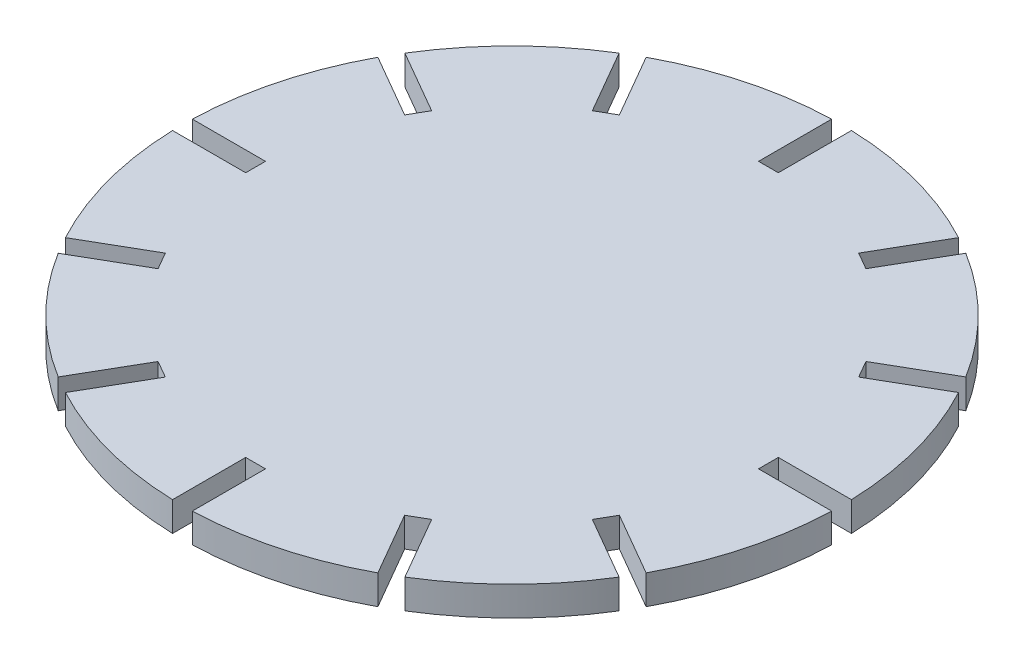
SolidWorks part; units mm, degrees
ref_plane "Front Plane" through (0, 0, 0) normal (0, 0, 1) x (1, 0, 0)
ref_plane "Top Plane" through (0, 0, 0) normal (0, 1, 0) x (1, 0, 0)
ref_plane "Right Plane" through (0, 0, 0) normal (1, 0, 0) x (0, 0, -1)
sketch "Sketch1" plane through (0, 0, 0) normal (0, 1, 0) x (1, 0, 0)
  line L0 (0, 34.9997) -> (0, -45) construction
  line L1 (30.9857, -16.3307) -> (39.6286, -21.3207)
  line L2 (55.4826, 0) -> (45, 0) construction
  line L3 (34.9997, -1.35) -> (44.9797, -1.35)
  line L4 (34.9997, -1.35) -> (34.9997, 1.35)
  line L5 (34.9997, 1.35) -> (44.9797, 1.35)
  line L7 (34.9997, -1.35) -> (44.9797, 1.35) construction
  line L8 (34.9997, 1.35) -> (44.9797, -1.35) construction
  line L9 (29.6357, -18.669) -> (38.2786, -23.659)
  line L10 (29.6357, -18.669) -> (30.9857, -16.3307)
  line L11 (18.669, -29.6357) -> (23.659, -38.2786)
  line L12 (16.3307, -30.9857) -> (21.3207, -39.6286)
  line L13 (16.3307, -30.9857) -> (18.669, -29.6357)
  line L14 (1.35, -34.9997) -> (1.35, -44.9797)
  line L15 (-1.35, -34.9997) -> (-1.35, -44.9797)
  line L16 (-1.35, -34.9997) -> (1.35, -34.9997)
  line L17 (-16.3307, -30.9857) -> (-21.3207, -39.6286)
  line L18 (-18.669, -29.6357) -> (-23.659, -38.2786)
  line L19 (-18.669, -29.6357) -> (-16.3307, -30.9857)
  line L20 (-29.6357, -18.669) -> (-38.2786, -23.659)
  line L21 (-30.9857, -16.3307) -> (-39.6286, -21.3207)
  line L22 (-30.9857, -16.3307) -> (-29.6357, -18.669)
  line L23 (-34.9997, -1.35) -> (-44.9797, -1.35)
  line L24 (-34.9997, 1.35) -> (-44.9797, 1.35)
  line L25 (-34.9997, 1.35) -> (-34.9997, -1.35)
  line L26 (-30.9857, 16.3307) -> (-39.6286, 21.3207)
  line L27 (-29.6357, 18.669) -> (-38.2786, 23.659)
  line L28 (-29.6357, 18.669) -> (-30.9857, 16.3307)
  line L29 (-18.669, 29.6357) -> (-23.659, 38.2786)
  line L30 (-16.3307, 30.9857) -> (-21.3207, 39.6286)
  line L31 (-16.3307, 30.9857) -> (-18.669, 29.6357)
  line L32 (-1.35, 34.9997) -> (-1.35, 44.9797)
  line L33 (1.35, 34.9997) -> (1.35, 44.9797)
  line L34 (1.35, 34.9997) -> (-1.35, 34.9997)
  line L35 (16.3307, 30.9857) -> (21.3207, 39.6286)
  line L36 (18.669, 29.6357) -> (23.659, 38.2786)
  line L37 (18.669, 29.6357) -> (16.3307, 30.9857)
  line L38 (29.6357, 18.669) -> (38.2786, 23.659)
  line L39 (30.9857, 16.3307) -> (39.6286, 21.3207)
  line L40 (30.9857, 16.3307) -> (29.6357, 18.669)
  line L41 (39.9897, 0) -> (-45, 0) construction
  arc A0 (44.9797, 1.35) -> (39.6286, 21.3207) centre (0, 0) ccw
  arc A1 (39.6286, -21.3207) -> (44.9797, -1.35) centre (0, 0) ccw
  arc A2 (23.659, -38.2786) -> (38.2786, -23.659) centre (0, 0) ccw
  arc A3 (1.35, -44.9797) -> (21.3207, -39.6286) centre (0, 0) ccw
  arc A4 (-21.3207, -39.6286) -> (-1.35, -44.9797) centre (0, 0) ccw
  arc A5 (-38.2786, -23.659) -> (-23.659, -38.2786) centre (0, 0) ccw
  arc A6 (-44.9797, -1.35) -> (-39.6286, -21.3207) centre (0, 0) ccw
  arc A7 (-39.6286, 21.3207) -> (-44.9797, 1.35) centre (0, 0) ccw
  arc A8 (-23.659, 38.2786) -> (-38.2786, 23.659) centre (0, 0) ccw
  arc A9 (-1.35, 44.9797) -> (-21.3207, 39.6286) centre (0, 0) ccw
  arc A10 (21.3207, 39.6286) -> (1.35, 44.9797) centre (0, 0) ccw
  arc A11 (38.2786, 23.659) -> (23.659, 38.2786) centre (0, 0) ccw
  point P7 (39.9897, 0)
  point P58 (0, 0)
extrude "Boss-Extrude1" add sketch "Sketch1" along normal blind 4
equation "\"t\"= 3"
equation "\"k\"= .15"
equation "\"s\"= \"t\" - ( 2 * \"k\" )"
equation "\"D3@Sketch1\"=\"s\""
